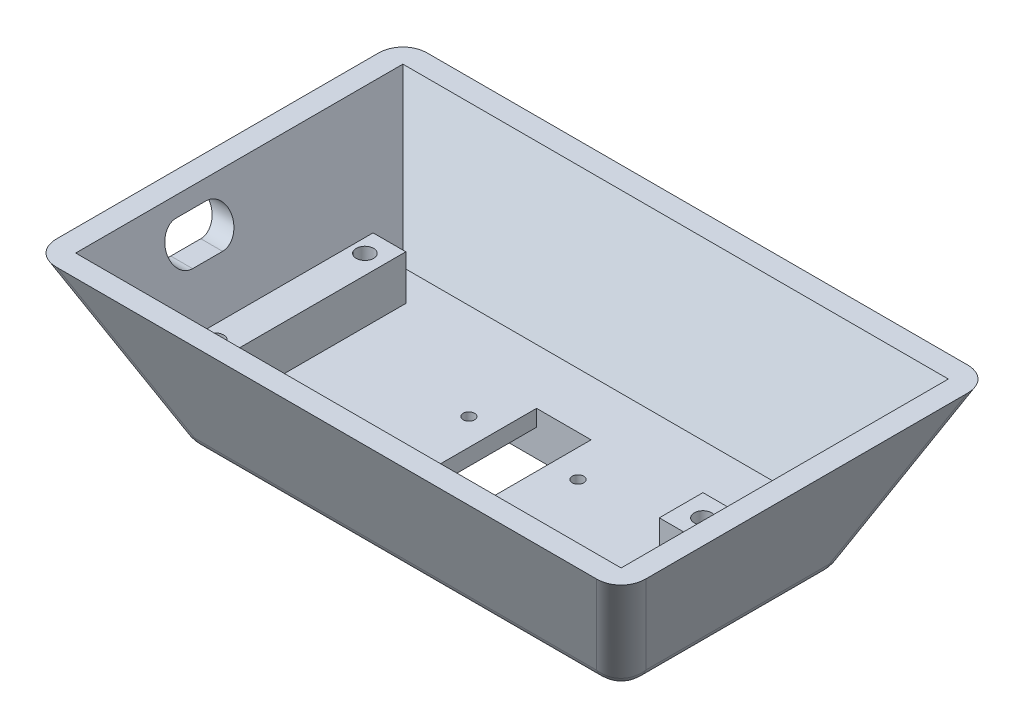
SolidWorks part; units mm, degrees
ref_plane "Front Plane" through (0, 0, 0) normal (0, 0, 1) x (1, 0, 0)
ref_plane "Top Plane" through (0, 0, 0) normal (0, 1, 0) x (1, 0, 0)
ref_plane "Right Plane" through (0, 0, 0) normal (1, 0, 0) x (0, 0, -1)
sketch "Sketch1" plane through (0, 0, 0) normal (0, 1, 0) x (1, 0, 0)
  line L1 (-40, 20) -> (40, 20)
  line L2 (-40, 20) -> (-40, -20)
  line L3 (-40, -20) -> (40, -20)
  line L4 (40, 20) -> (40, -20)
  line L5 (-40, 20) -> (40, -20) construction
  line L6 (-40, -20) -> (40, 20) construction
  point P0 (0, 0)
  dimension "D1" = 40
  dimension "D2" = 80
extrude "Base Extrusion" add sketch "Sketch1" along normal blind 30 draft 25
sketch "Sketch2" plane through (0, 0, 0) normal (0, -1, 0) x (1, 0, 0)
  line L0 (0, 9.6) -> (0, 20) construction
  line L1 (-15.1, 9.6) -> (15.1, 9.6)
  line L2 (-15.1, 9.6) -> (-15.1, -9.6)
  line L3 (-15.1, -9.6) -> (15.1, -9.6)
  line L4 (15.1, 9.6) -> (15.1, -9.6)
  line L5 (-15.1, 9.6) -> (15.1, -9.6) construction
  line L6 (-15.1, -9.6) -> (15.1, 9.6) construction
  line L7 (-40, 20) -> (40, 20) construction
  point P0 (0, 0)
  dimension "D1" = 19.2
  dimension "D2" = 30.2
  dimension "D3" = 10.4
extrude "Triangle Attach Cutout" cut sketch "Sketch2" against normal blind 5
sketch "Sketch3" plane through (0, 30, 0) normal (0, 1, 0) x (1, 0, 0)
  line L17 (-49.9892, 29.9892) -> (-49.9892, -29.9892)
  line L18 (-49.9892, -29.9892) -> (49.9892, -29.9892)
  line L19 (49.9892, -29.9892) -> (49.9892, 29.9892)
  line L20 (49.9892, 29.9892) -> (-49.9892, 29.9892)
  line L21 (-49.9892, 29.9892) -> (-49.9892, -29.9892)
  line L22 (-49.9892, -29.9892) -> (49.9892, -29.9892)
  line L23 (49.9892, -29.9892) -> (49.9892, 29.9892)
  line L24 (49.9892, 29.9892) -> (-49.9892, 29.9892)
  dimension "D2" = 4
extrude "Shell out the base" cut sketch "Sketch3" against normal blind 22 draft 25
sketch "Sketch5" plane through (0, 5, 0) normal (0, -1, 0) x (1, 0, 0)
  line L0 (0, -2.1) -> (-10, -2.1) construction
  line L1 (0, -1000) -> (0, 49000) construction
  line L2 (-5.1, 5.6) -> (-5.1, 9.6) construction
  line L3 (15.1, 9.6) -> (-15.1, 9.6) construction
  line L4 (-5.1, 9.6) -> (4.9, 9.6) construction
  line L6 (4.9, 9.6) -> (-5.1, 9.6)
  line L7 (4.9, 9.6) -> (4.9, -9.6)
  line L8 (4.9, -9.6) -> (-5.1, -9.6)
  line L9 (-5.1, 9.6) -> (-5.1, -9.6)
  line L11 (-15.1, -9.6) -> (15.1, -9.6) construction
  circle A0 centre (-10, -2.1) radius 1.05
  circle A2 centre (10, -2.1) radius 1.05
  dimension "D3" = 2.1
  dimension "D1" = 10
  dimension "D2" = 2.1
  dimension "D5" = 4
  dimension "D6" = 10
extrude "LED Strip Cutout" cut sketch "Sketch5" against normal up to next
sketch "Sketch13" plane through (0, 0, 0) normal (0, 1, 0) x (1, 0, 0)
  line L0 (-39.7305, -19.7305) -> (39.7305, -19.7305) construction
  line L1 (-39.7305, -19.7305) -> (-33.7305, -19.7305)
  line L2 (-39.7305, -19.7305) -> (-39.7305, 14.2695)
  line L3 (-39.7305, 14.2695) -> (-33.7305, 14.2695)
  line L4 (-33.7305, -19.7305) -> (-33.7305, 14.2695)
  line L5 (31.7305, -4.7305) -> (39.7305, -4.7305)
  line L6 (31.7305, -4.7305) -> (31.7305, 3.2695)
  line L7 (31.7305, 3.2695) -> (39.7305, 3.2695)
  line L8 (39.7305, -4.7305) -> (39.7305, 3.2695)
  line L9 (39.7305, -19.7305) -> (39.7305, 19.7305) construction
  line L10 (31.7305, -0.7305) -> (39.7305, -0.7305) construction
  line L11 (-39.7305, 19.7305) -> (-39.7305, -19.7305) construction
  circle A0 centre (35.7305, -0.7305) radius 1.6002
  circle A1 centre (-37.2305, 10.2695) radius 1.6002
  circle A2 centre (-37.2305, -17.2305) radius 1.6002
  dimension "D6" = 2.5
  dimension "D7" = 3.2004
  dimension "D1" = 34
  dimension "D2" = 6
  dimension "D3" = 15
  dimension "D4" = 8
  dimension "D5" = 8
  dimension "D8" = 2.5
  dimension "D9" = 30
  dimension "D10" = 2.5
extrude "PCB Ledge" add sketch "Sketch13" along normal blind 8.2 from surface at 8
sketch "Sketch14" plane through (0, 0, 0) normal (1, 0, 0) x (0, 0, -1)
  line L0 (-12.75, 24.25) -> (-7.25, 24.25) construction
  line L1 (-12.75, 27.5) -> (-7.25, 27.5)
  line L2 (-12.75, 21) -> (-7.25, 21)
  arc A0 (-12.75, 27.5) -> (-12.75, 21) centre (-12.75, 24.25) ccw
  arc A1 (-7.25, 21) -> (-7.25, 27.5) centre (-7.25, 24.25) ccw
  point P2 (-10, 24.25)
  point P7 (-16, 24.25)
  point P8 (-4, 24.25)
  dimension "D1" = 24.25
  dimension "D4" = 12
  dimension "D2" = 10
  dimension "D3" = 6.5
extrude "USB-C Cutout" cut sketch "Sketch14" against normal up to next
fillet "Fillet1" radius 5 8 edges at (-40, 0, 0) (0, 0, 20) (40, 0, 0) (0, 0, -20) (-46.9946, 15, 26.9946) (46.9946, 15, 26.9946) (46.9946, 15, -26.9946) (-46.9946, 15, -26.9946)
